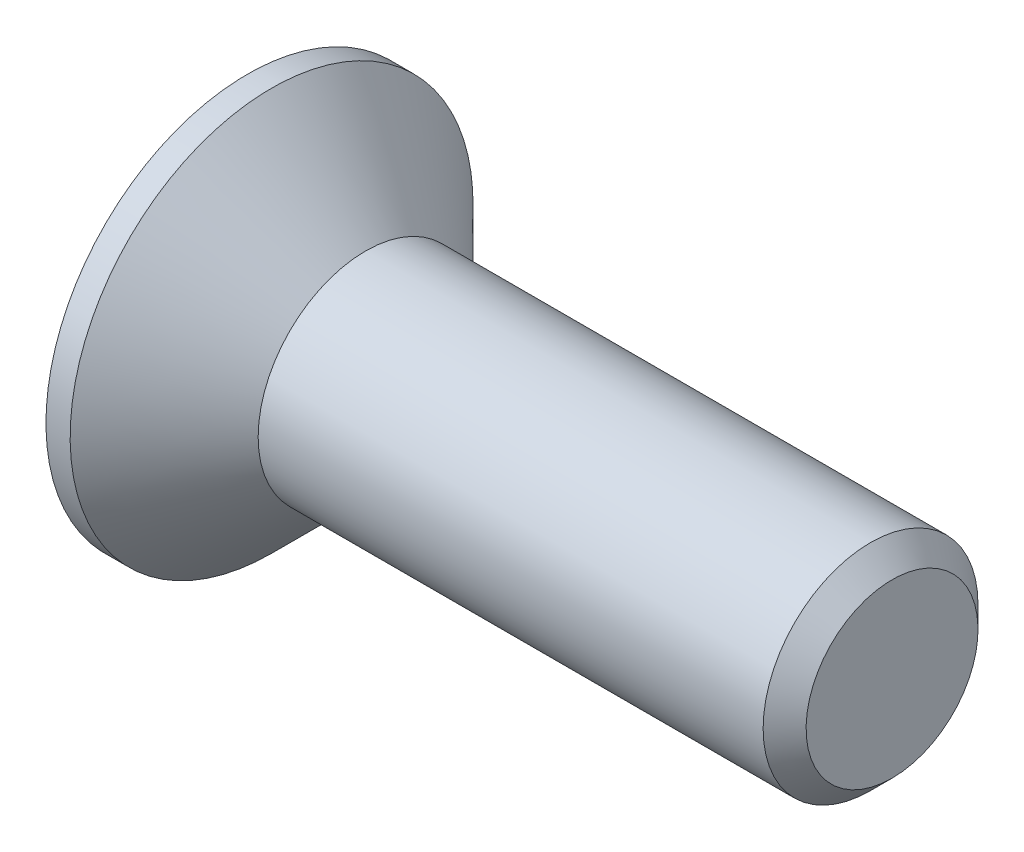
SolidWorks part; units mm, degrees
ref_plane "Front Plane" through (0, 0, 0) normal (0, 0, 1) x (1, 0, 0)
ref_plane "Top Plane" through (0, 0, 0) normal (0, 1, 0) x (1, 0, 0)
ref_plane "Right Plane" through (0, 0, 0) normal (1, 0, 0) x (0, 0, -1)
sketch "Sketch1" plane through (0, 0, 0) normal (0, 0, 1) x (1, 0, 0)
  line L1 (-2.2, 3.75) -> (-2.2, 0)
  line L2 (-2.2, 0) -> (9.8, 0)
  line L3 (9.8, 0) -> (9.8, 2)
  line L4 (9.8, 2) -> (0, 2)
  line L5 (-2.2, 3.75) -> (-1.75, 3.75)
  line L6 (-1.75, 3.75) -> (0, 2)
  dimension "D1" = 2
  dimension "D2" = 45
  dimension "D3" = 2.2
  dimension "D4" = 12
  dimension "D5" = 3.75
revolve "Revolve1" add sketch "Sketch1" angle 360 about L2
chamfer "Chamfer1" distance 0.4 angle 45 1 edges at (9.8, -2, 0)
sketch "Sketch2" plane through (-2.2, 0, 0) normal (-1, 0, 0) x (0, 0, 1)
  line L0 (-0.55, 2.2) -> (0.55, 2.2)
  line L1 (0.55, 2.2) -> (0.55, 0.55)
  line L2 (0.55, 0.55) -> (2.2, 0.55)
  line L3 (2.2, 0.55) -> (2.2, -0.55)
  line L4 (2.2, -0.55) -> (0.55, -0.55)
  line L5 (0.55, -0.55) -> (0.55, -2.2)
  line L6 (0.55, -2.2) -> (-0.55, -2.2)
  line L7 (-0.55, -2.2) -> (-0.55, -0.55)
  line L8 (-0.55, -0.55) -> (-2.2, -0.55)
  line L9 (-2.2, -0.55) -> (-2.2, 0.55)
  line L10 (-2.2, 0.55) -> (-0.55, 0.55)
  line L11 (-0.55, 0.55) -> (-0.55, 2.2)
  point P2 (0, 2.2)
  point P14 (0, -2.2)
  point P15 (2.2, 0)
  point P16 (-2.2, 0)
  dimension "D1" = 4.4
  dimension "D2" = 1.1
extrude "Cut-Extrude1" cut sketch "Sketch2" against normal blind 1.9
